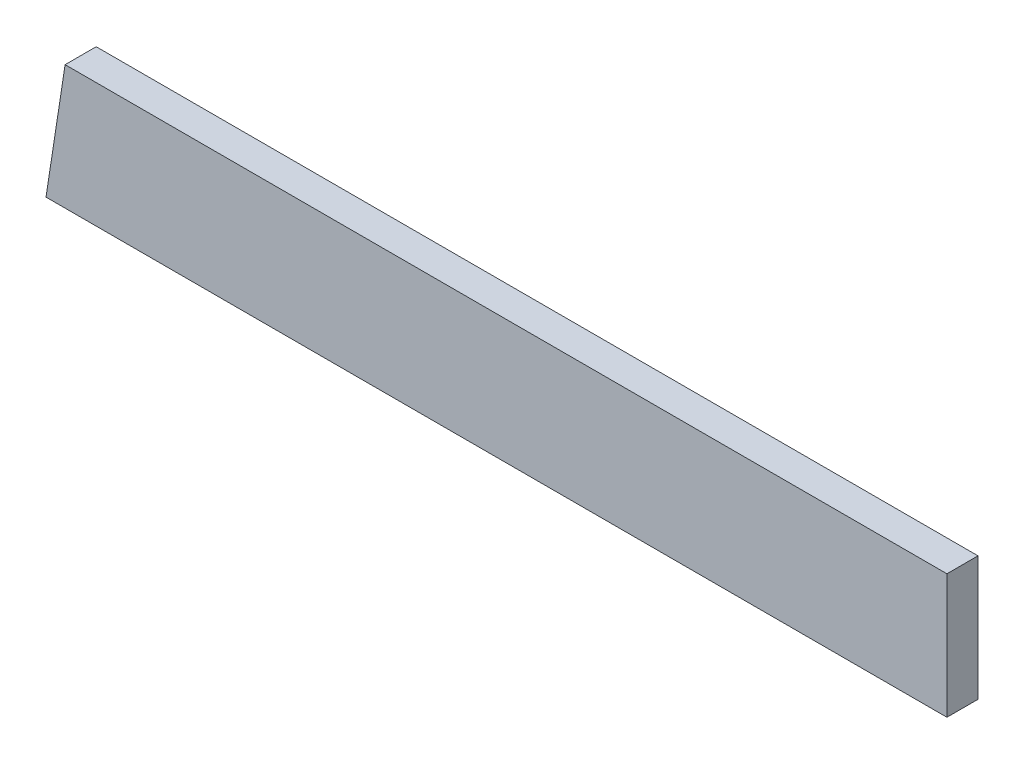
SolidWorks part; units mm, degrees
ref_plane "Front Plane" through (0, 0, 0) normal (0, 0, 1) x (1, 0, 0)
ref_plane "Top Plane" through (0, 0, 0) normal (0, 1, 0) x (1, 0, 0)
ref_plane "Right Plane" through (0, 0, 0) normal (1, 0, 0) x (0, 0, -1)
sketch "Sketch1" plane through (0, 0, 0) normal (0, 0, 1) x (1, 0, 0)
  line L0 (0, -50.8) -> (0, -2032) construction
  line L1 (-473.0229, 50.8) -> (473.0229, 50.8) construction
  line L3 (-713.4762, -50.8) -> (713.4762, -50.8) construction
  line L5 (-812.8, 50.8) -> (812.8, -50.8) construction
  line L6 (-812.8, -50.8) -> (812.8, 50.8) construction
  line L7 (-1219.2, -2032) -> (1219.2, -2032) construction
  line L8 (-914.4, -50.8) -> (914.4, -50.8) construction
  line L9 (-1219.2, -2032) -> (-914.4, -50.8) construction
  line L10 (-1116.4047, -2032) -> (-811.6047, -50.8) construction
  line L11 (-1118.7814, -2047.449) -> (-813.9814, -66.249) construction
  line L12 (0, -50.8) -> (0, 355.6) construction
  line L13 (-12.7, -50.8) -> (-12.7, 355.6) construction
  line L14 (-914.4, -25.4) -> (-12.7, 355.6) construction
  line L15 (-914.4, -50.8) -> (-812.8, -50.8) construction
  line L16 (-914.4, -50.8) -> (-914.4, -25.4) construction
  line L17 (-914.4, -25.4) -> (-812.8, -25.4) construction
  line L19 (-818.427, -95.1454) -> (-12.7, 245.3026) construction
  line L20 (-914.4, -25.4) -> (-812.8, -25.4) construction
  line L21 (-812.8, -25.4) -> (-812.8, -50.8) construction
  line L22 (-874.8556, -118.9885) -> (26.8444, 262.0115) construction
  line L23 (-812.8, -50.8) -> (-811.6047, -50.8) construction
  line L24 (-811.6047, -50.8) -> (-818.427, -95.1454) construction
  line L25 (-12.7, 355.6) -> (-12.7, 245.3026) construction
  line L26 (-713.4762, -50.8) -> (-473.0229, 50.8) construction
  line L27 (713.4762, -50.8) -> (473.0229, 50.8) construction
  line L28 (12.7, -50.8) -> (12.7, 355.6) construction
  line L29 (914.4, -50.8) -> (914.4, -25.4) construction
  line L30 (914.4, -25.4) -> (12.7, 355.6) construction
  line L31 (914.4, -25.4) -> (812.8, -25.4) construction
  line L32 (812.8, -25.4) -> (812.8, -50.8) construction
  line L33 (818.427, -95.1454) -> (12.7, 245.3026) construction
  line L34 (1219.2, -2032) -> (914.4, -50.8) construction
  line L35 (1116.4047, -2032) -> (811.6047, -50.8) construction
  point P0 (0, 0)
  point P11 (0, -2032)
  point P13 (0, -50.8)
  dimension "D1" = 101.6
  dimension "D2" = 1625.6
  dimension "D3" = 1981.2
  dimension "D4" = 2438.4
  dimension "D5" = 1828.8
  dimension "D7" = 406.4
  dimension "D9" = 25.4
  dimension "D10" = 101.6
  dimension "D6" = 101.6
  dimension "D8" = 12.7
  dimension "D11" = 101.6
sketch "Sketch2" plane through (0, 0, 0) normal (0, 0, 1) x (1, 0, 0)
  line L0 (-1117.6, -1371.6) -> (-381.1172, -1371.6)
  line L3 (-1101.9692, -1270) -> (-381.1172, -1270)
  line L4 (-1219.2, -2032) -> (1219.2, -2032) construction
  line L8 (-1014.8047, -1270) -> (1014.8047, -1270) construction
  line L9 (-1014.8047, -1371.6) -> (1014.8047, -1371.6) construction
  line L11 (-1219.2, -2032) -> (-914.4, -50.8) construction
  line L13 (-1101.9692, -1270) -> (-1117.6, -1371.6)
  line L14 (-381.1172, -1270) -> (-381.1172, -1371.6)
  dimension "D2" = 762
  dimension "D3" = 720.852
  dimension "D1" = 101.6
extrude "Boss-Extrude1" add sketch "Sketch2" along normal blind 25.4 contours L3 L14 L0 L13
